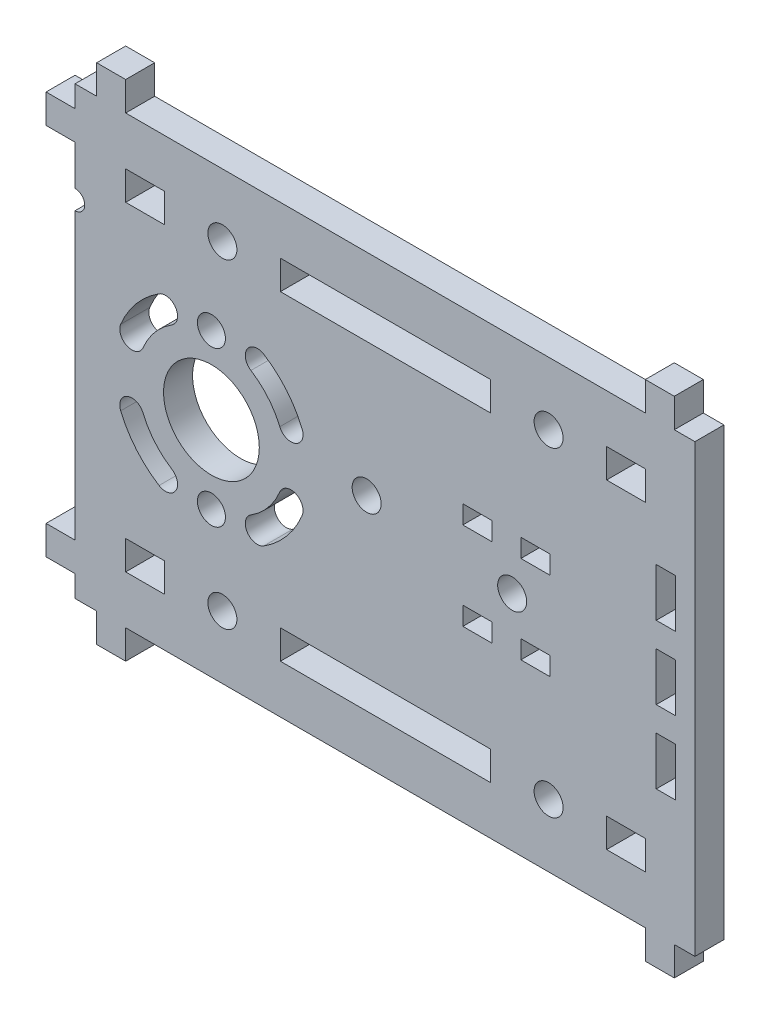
SolidWorks part; units mm, degrees
ref_plane "Front Plane" through (0, 0, 0) normal (0, 0, 1) x (1, 0, 0)
ref_plane "Top Plane" through (0, 0, 0) normal (0, 1, 0) x (1, 0, 0)
ref_plane "Right Plane" through (0, 0, 0) normal (1, 0, 0) x (0, 0, -1)
sketch "Model" plane through (0, 0, 0) normal (0, 0, 1) x (1, 0, 0)
  line L0 (203.8139, 138.8784) -> (203.8139, 92.7784)
  line L1 (201.682, 141.8784) -> (201.682, 138.8784)
  line L2 (198.682, 141.8784) -> (198.682, 138.8784)
  line L3 (144.9458, 138.8784) -> (144.9458, 141.8784)
  line L4 (141.9458, 138.8784) -> (141.9458, 141.8784)
  line L5 (139.7139, 138.8784) -> (141.9458, 138.8784)
  line L6 (201.682, 138.8784) -> (203.8139, 138.8784)
  line L7 (144.9458, 138.8784) -> (198.682, 138.8784)
  line L8 (144.9458, 133.8784) -> (148.9458, 133.8784)
  line L9 (160.9458, 133.8784) -> (182.682, 133.8784)
  line L10 (194.682, 133.8784) -> (198.682, 133.8784)
  line L11 (144.9458, 130.8784) -> (148.9458, 130.8784)
  line L12 (160.9458, 130.8784) -> (182.682, 130.8784)
  line L13 (194.682, 130.8784) -> (198.682, 130.8784)
  line L14 (141.9458, 89.7784) -> (144.9458, 89.7784)
  line L15 (198.682, 89.7784) -> (201.682, 89.7784)
  line L16 (201.682, 89.7784) -> (201.682, 92.7784)
  line L17 (198.682, 89.7784) -> (198.682, 92.7784)
  line L18 (144.9458, 92.7784) -> (144.9458, 89.7784)
  line L19 (141.9458, 92.7784) -> (141.9458, 89.7784)
  line L20 (139.7139, 92.7784) -> (141.9458, 92.7784)
  line L21 (201.682, 92.7784) -> (203.8139, 92.7784)
  line L22 (144.9458, 92.7784) -> (198.682, 92.7784)
  line L23 (144.9458, 130.8784) -> (144.9458, 133.8784)
  line L24 (148.9458, 130.8784) -> (148.9458, 133.8784)
  line L25 (160.9458, 130.8784) -> (160.9458, 133.8784)
  line L26 (198.682, 133.8784) -> (198.682, 130.8784)
  line L27 (194.682, 133.8784) -> (194.682, 130.8784)
  line L28 (182.682, 133.8784) -> (182.682, 130.8784)
  line L29 (144.9458, 97.7784) -> (148.9458, 97.7784)
  line L30 (160.9458, 97.7784) -> (182.682, 97.7784)
  line L31 (194.682, 97.7784) -> (198.682, 97.7784)
  line L32 (144.9458, 100.7784) -> (148.9458, 100.7784)
  line L33 (160.9458, 100.7784) -> (182.682, 100.7784)
  line L34 (194.682, 100.7784) -> (198.682, 100.7784)
  line L35 (144.9458, 100.7784) -> (144.9458, 97.7784)
  line L36 (148.9458, 100.7784) -> (148.9458, 97.7784)
  line L37 (160.9458, 100.7784) -> (160.9458, 97.7784)
  line L38 (198.682, 97.7784) -> (198.682, 100.7784)
  line L39 (194.682, 97.7784) -> (194.682, 100.7784)
  line L40 (182.682, 97.7784) -> (182.682, 100.7784)
  line L41 (141.9458, 141.8784) -> (144.9458, 141.8784)
  line L42 (198.682, 141.8784) -> (201.682, 141.8784)
  line L135 (139.7139, 92.7784) -> (139.7139, 95.0103)
  line L136 (139.7139, 136.6465) -> (139.7139, 138.8784)
  line L137 (136.7139, 133.6465) -> (136.7139, 136.6465)
  line L138 (139.7139, 136.6465) -> (136.7139, 136.6465)
  line L139 (139.7139, 133.6465) -> (136.7139, 133.6465)
  line L140 (136.7139, 98.0103) -> (136.7139, 95.0103)
  line L141 (139.7139, 95.0103) -> (136.7139, 95.0103)
  line L142 (139.7139, 98.0103) -> (136.7139, 98.0103)
  line L153 (139.7139, 98.0103) -> (139.7139, 127.5143)
  line L154 (139.7139, 129.5143) -> (139.7139, 133.6465)
  line L173 (188.8139, 121.3195) -> (188.8139, 119.4195)
  line L174 (185.8139, 121.3195) -> (185.8139, 119.4195)
  line L175 (182.8139, 121.3195) -> (182.8139, 119.4195)
  line L176 (179.8139, 121.3195) -> (179.8139, 119.4195)
  line L177 (179.8139, 119.4195) -> (182.8139, 119.4195)
  line L178 (185.8139, 119.4195) -> (188.8139, 119.4195)
  line L179 (179.8139, 121.3195) -> (182.8139, 121.3195)
  line L180 (185.8139, 121.3195) -> (188.8139, 121.3195)
  line L181 (188.8139, 110.3373) -> (188.8139, 112.2373)
  line L182 (185.8139, 110.3373) -> (185.8139, 112.2373)
  line L183 (182.8139, 110.3373) -> (182.8139, 112.2373)
  line L184 (179.8139, 110.3373) -> (179.8139, 112.2373)
  line L185 (179.8139, 112.2373) -> (182.8139, 112.2373)
  line L186 (185.8139, 112.2373) -> (188.8139, 112.2373)
  line L187 (179.8139, 110.3373) -> (182.8139, 110.3373)
  line L188 (185.8139, 110.3373) -> (188.8139, 110.3373)
  line L189 (201.8139, 125.8784) -> (201.8139, 120.8784)
  line L190 (201.8139, 118.3284) -> (201.8139, 113.3284)
  line L191 (201.8139, 110.7784) -> (201.8139, 105.7784)
  line L192 (199.8139, 125.8784) -> (199.8139, 120.8784)
  line L193 (199.8139, 118.3284) -> (199.8139, 113.3284)
  line L194 (199.8139, 110.7784) -> (199.8139, 105.7784)
  line L195 (199.8139, 125.8784) -> (201.8139, 125.8784)
  line L196 (199.8139, 120.8784) -> (201.8139, 120.8784)
  line L197 (199.8139, 105.7784) -> (201.8139, 105.7784)
  line L198 (199.8139, 110.7784) -> (201.8139, 110.7784)
  line L199 (199.8139, 113.3284) -> (201.8139, 113.3284)
  line L200 (199.8139, 118.3284) -> (201.8139, 118.3284)
  circle A0 centre (153.8139, 115.8284) radius 4.9501
  circle A1 centre (153.8139, 123.8284) radius 1.45
  circle A2 centre (153.8139, 107.8284) radius 1.45
  arc A3 (148.3968, 124.412) -> (144.4338, 119.706) centre (153.8139, 115.8284) ccw
  arc A4 (144.4338, 111.9509) -> (148.3968, 107.2449) centre (153.8139, 115.8284) ccw
  arc A5 (163.1941, 119.706) -> (159.231, 124.412) centre (153.8139, 115.8284) ccw
  arc A6 (149.731, 122.2978) -> (146.7441, 118.7509) centre (153.8139, 115.8284) ccw
  arc A7 (146.7441, 112.906) -> (149.731, 109.3591) centre (153.8139, 115.8284) ccw
  arc A8 (157.8968, 109.3591) -> (160.8837, 112.906) centre (153.8139, 115.8284) ccw
  arc A9 (160.8837, 118.7509) -> (157.8968, 122.2978) centre (153.8139, 115.8284) ccw
  arc A10 (159.231, 124.412) -> (157.8968, 122.2978) centre (158.5639, 123.3549) ccw
  arc A11 (160.8837, 118.7509) -> (163.1941, 119.706) centre (162.0389, 119.2284) ccw
  arc A12 (163.1941, 111.9509) -> (160.8837, 112.906) centre (162.0389, 112.4284) ccw
  arc A13 (157.8968, 109.3591) -> (159.231, 107.2449) centre (158.5639, 108.302) ccw
  arc A14 (148.3968, 107.2449) -> (149.731, 109.3591) centre (149.0639, 108.302) ccw
  arc A15 (146.7441, 112.906) -> (144.4338, 111.9509) centre (145.5889, 112.4284) ccw
  arc A16 (144.4338, 119.706) -> (146.7441, 118.7509) centre (145.5889, 119.2284) ccw
  arc A17 (149.731, 122.2978) -> (148.3968, 124.412) centre (149.0639, 123.3549) ccw
  circle A18 centre (188.682, 132.3784) radius 1.5
  circle A19 centre (154.9458, 132.3784) radius 1.5
  circle A20 centre (188.682, 99.2784) radius 1.5
  circle A21 centre (154.9458, 99.2784) radius 1.5
  circle A22 centre (184.9139, 115.8284) radius 1.5
  arc A45 (159.231, 107.2449) -> (163.1941, 111.9509) centre (153.8139, 115.8284) ccw
  arc A47 (139.7139, 127.5143) -> (139.7139, 129.5143) centre (139.7139, 128.5143) ccw
  circle A49 centre (169.8655, 117.0758) radius 1.5
extrude "Boss-Extrude1" add sketch "Model" along normal blind 3
